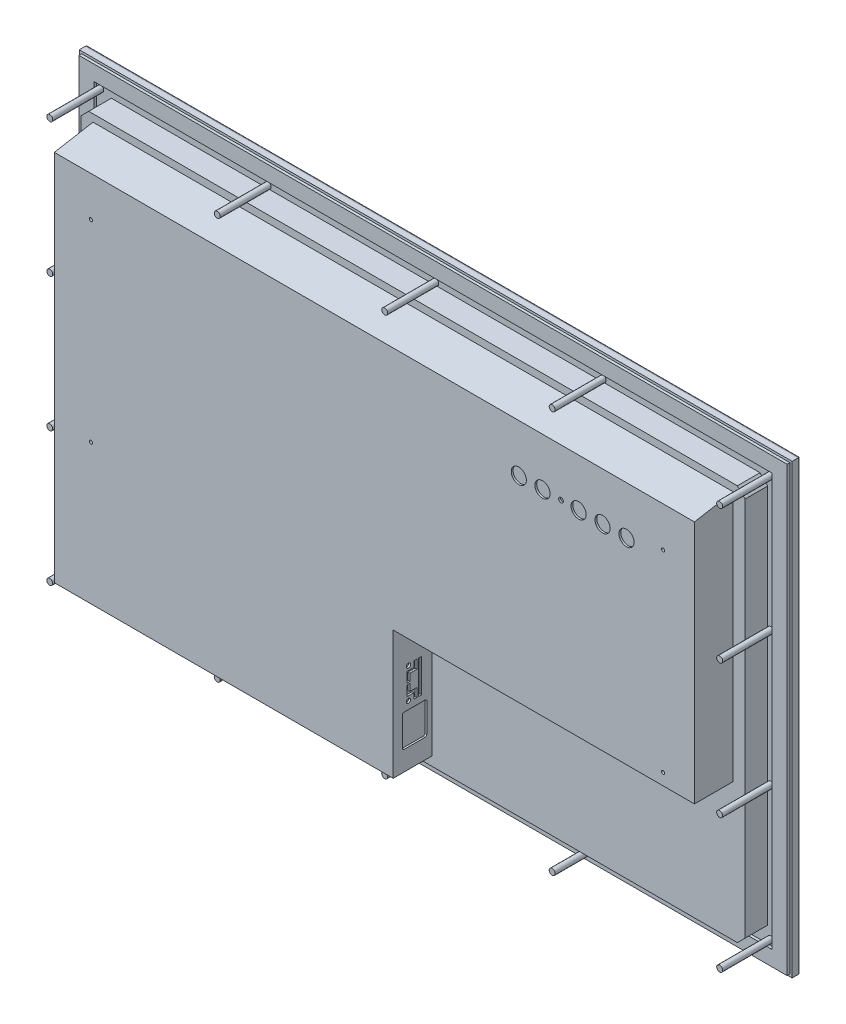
SolidWorks part; units mm, degrees
ref_plane "Front Plane" through (0, 0, 0) normal (0, 0, 1) x (1, 0, 0)
ref_plane "Top Plane" through (0, 0, 0) normal (0, 1, 0) x (1, 0, 0)
ref_plane "Right Plane" through (0, 0, 0) normal (1, 0, 0) x (0, 0, -1)
sketch "Sketch1" plane through (0, 0, 0) normal (0, 0, 1) x (1, 0, 0)
  line L0 (-298.45, 187.325) -> (298.45, 187.325)
  line L1 (298.45, 187.325) -> (298.45, -187.325)
  line L2 (298.45, -187.325) -> (-298.45, -187.325)
  line L3 (-298.45, -187.325) -> (-298.45, 187.325)
  point P2 (0, -187.325)
  point P3 (298.45, 0)
  dimension "D1" = 596.9
  dimension "D2" = 374.65
extrude "Bezel" add sketch "Sketch1" against normal blind 7.112
fillet "Bezel Radius" radius 2 4 edges at (0, -187.325, -7.112) (0, 187.325, -7.112) (-298.45, 0, -7.112) (298.45, 0, -7.112)
sketch "Sketch2" plane through (0, 0, -7.112) normal (0, 0, -1) x (-1, 0, 0)
  line L0 (-256.7686, 145.2626) -> (256.7686, 145.2626)
  line L1 (256.7686, 145.2626) -> (256.7686, -145.2626)
  line L2 (256.7686, -145.2626) -> (-256.7686, -145.2626)
  line L3 (-256.7686, -145.2626) -> (-256.7686, 145.2626)
  line L4 (296.45, 185.325) -> (-296.45, 185.325) construction
  line L5 (-296.45, 185.325) -> (-296.45, -185.325) construction
  point P0 (0, 145.2626)
  point P6 (0, 185.325)
  point P8 (-256.7686, 0)
  point P11 (-296.45, 0)
  dimension "D1" = 513.5372
  dimension "D2" = 290.5252
extrude "Window" cut sketch "Sketch2" against normal blind 2.35
sketch "Sketch3" plane through (0, 0, 0) normal (0, 0, 1) x (1, 0, 0)
  line L4 (-296.545, 185.42) -> (296.545, 185.42)
  line L5 (296.545, 185.42) -> (296.545, -185.42)
  line L6 (296.545, -185.42) -> (-296.545, -185.42)
  line L7 (-296.545, -185.42) -> (-296.545, 185.42)
  line L8 (298.45, 187.325) -> (-298.45, 187.325) construction
  line L9 (-298.45, 187.325) -> (-298.45, -187.325) construction
  line L10 (-298.45, -187.325) -> (298.45, -187.325) construction
  line L11 (298.45, -187.325) -> (298.45, 187.325) construction
  line L12 (-283.845, -172.72) -> (-283.845, 172.72)
  line L13 (-283.845, 172.72) -> (283.845, 172.72)
  line L14 (283.845, 172.72) -> (283.845, -172.72)
  line L15 (283.845, -172.72) -> (-283.845, -172.72)
  dimension "D1" = 1.905
  dimension "D2" = 1.905
  dimension "D3" = 1.905
  dimension "D4" = 1.905
  dimension "D5" = 12.7
extrude "Gasket" add sketch "Sketch3" along normal blind 2.3
sketch "Sketch5" plane through (0, 0, 0) normal (0, 0, 1) x (1, 0, 0)
  line L0 (-298.45, 187.325) -> (-298.45, -187.325) construction
  line L1 (298.45, 187.325) -> (-298.45, 187.325) construction
  circle A0 centre (-280.4668, 168.1226) radius 2.5
  circle A22 centre (-140.2334, 168.1226) radius 2.5
  circle A23 centre (-140.2334, -168.148) radius 2.5
  circle A24 centre (0, 168.1226) radius 2.5
  circle A25 centre (0, -168.148) radius 2.5
  circle A26 centre (140.2334, 168.1226) radius 2.5
  circle A27 centre (140.2334, -168.148) radius 2.5
  circle A28 centre (280.4668, 168.1226) radius 2.5
  circle A29 centre (280.4668, -168.148) radius 2.5
  circle A31 centre (-280.4668, -56.0578) radius 2.5
  circle A32 centre (-280.4668, -168.148) radius 2.5
  circle A33 centre (-280.4668, 56.0324) radius 2.5
  circle A34 centre (-280.4668, 56.0324) radius 2.5
  circle A35 centre (280.4668, 56.0324) radius 2.5
  circle A36 centre (-280.4668, -56.0578) radius 2.5
  circle A37 centre (280.4668, -56.0578) radius 2.5
  point P2 (0, 0)
  dimension "D1" = 5
  dimension "D2" = 17.9832
  dimension "D3" = 19.2024
  dimension "D4" = 3
  dimension "D5" = 140.2334
  dimension "D6" = 5
  dimension "D7" = 4
  dimension "D8" = 112.0902
extrude "Panel Frame Studs" add sketch "Sketch5" along normal blind 42.7
sketch "Sketch6" plane through (0, 0, 0) normal (0, 0, 1) x (1, 0, 0)
  line L0 (-277.9668, 159.2107) -> (-271.5549, 165.6226)
  line L1 (-271.5549, 165.6226) -> (271.5549, 165.6226)
  line L2 (271.5549, 165.6226) -> (277.9668, 159.2107)
  line L3 (277.9668, 159.2107) -> (277.9668, -159.2361)
  line L4 (277.9668, -159.2361) -> (271.5549, -165.648)
  line L5 (271.5549, -165.648) -> (-271.5549, -165.648)
  line L6 (-271.5549, -165.648) -> (-277.9668, -159.2361)
  line L7 (-277.9668, -159.2361) -> (-277.9668, 159.2107)
  circle A0 centre (-280.4668, 168.1226) radius 2.5 construction
  circle A6 centre (280.4668, 56.0324) radius 2.5 construction
  circle A7 centre (-140.2334, -168.148) radius 2.5 construction
  dimension "D1" = 9.0678
  dimension "D2" = 45
extrude "Body" add sketch "Sketch6" along normal blind 18.9738 separate body
sketch "Sketch7" plane through (0, 0, 18.9738) normal (0, 0, 1) x (1, 0, 0)
  line L0 (-267.97, 159.5374) -> (267.97, 159.5374)
  line L1 (267.97, 159.5374) -> (267.97, -50.673)
  line L2 (267.97, -50.673) -> (15.7226, -50.673)
  line L3 (15.7226, -50.673) -> (15.7226, -158.242)
  line L4 (15.7226, -158.242) -> (-267.97, -158.242)
  line L5 (-267.97, -158.242) -> (-267.97, 159.5374)
  line L6 (-271.5549, -165.648) -> (271.5549, -165.648) construction
  line L7 (-298.45, -187.325) -> (298.45, -187.325) construction
  line L9 (-277.9668, 159.2107) -> (-277.9668, -159.2361) construction
  point P3 (0, 159.5374)
  dimension "D1" = 535.94
  dimension "D2" = 210.2104
  dimension "D3" = 252.2474
  dimension "D4" = 107.569
  dimension "D5" = 29.083
extrude "Rear Cover" add sketch "Sketch7" along normal blind 32.3596
draft "Rear Cover Slope" type of draft neutral plane draft angle 10 faces to draft 1 parameters "D1"=10
sketch "Sketch10" plane through (0, -50.673, 0) normal (0, 1, 0) x (1, 0, 0)
  line L0 (267.97, -51.3334) -> (267.97, -18.9738) construction
  line L1 (15.7226, -51.3334) -> (267.97, -51.3334) construction
  line L2 (267.97, -51.3334) -> (-267.97, -51.3334) construction
  line L3 (267.97, -51.3334) -> (267.97, -18.9738) construction
  line L53 (123.8897, -41.2565) -> (123.8897, -36.1765)
  line L54 (99.6137, -44.429) -> (120.8417, -44.429)
  line L55 (99.6137, -33.0041) -> (120.8417, -33.0041)
  line L56 (96.5657, -36.1765) -> (96.5657, -41.2565)
  line L57 (160.3187, -37.6878) -> (160.3187, -42.7678)
  line L58 (143.0467, -45.9403) -> (157.2707, -45.9403)
  line L59 (139.9987, -37.6878) -> (139.9987, -42.7678)
  line L60 (143.0467, -34.5154) -> (157.1431, -34.5128)
  line L61 (198.4857, -27.9342) -> (198.4857, -33.0142)
  line L62 (215.7577, -24.7618) -> (201.5337, -24.7618)
  line L63 (218.8057, -33.0142) -> (218.8057, -27.9342)
  line L64 (201.5337, -36.1867) -> (215.6301, -36.1892)
  line L65 (252.2531, -24.3655) -> (236.2511, -24.3655)
  line L66 (252.2531, -32.049) -> (252.2531, -36.5575)
  line L67 (236.2511, -36.5575) -> (252.2531, -36.5575)
  line L68 (236.2511, -32.049) -> (236.2511, -36.5575)
  line L69 (231.8061, -32.049) -> (236.2511, -32.049)
  line L70 (231.8061, -28.874) -> (236.2511, -28.874)
  line L71 (236.2511, -24.3655) -> (236.2511, -28.874)
  line L72 (252.2531, -28.874) -> (252.2531, -24.3655)
  line L73 (252.2531, -32.049) -> (256.6981, -32.049)
  line L74 (252.2531, -28.874) -> (256.6981, -28.874)
  circle A42 centre (126.4837, -38.7165) radius 1.5875
  arc A43 (123.8897, -41.2565) -> (120.8417, -44.429) centre (120.7147, -41.2565) cw
  arc A44 (120.8417, -33.0041) -> (123.8897, -36.1765) centre (120.7147, -36.1765) cw
  arc A45 (96.5657, -36.1765) -> (99.6137, -33.0041) centre (99.7407, -36.1765) cw
  arc A46 (99.6137, -44.429) -> (96.5657, -41.2565) centre (99.7407, -41.2565) cw
  circle A47 centre (93.9717, -38.7165) radius 1.5875
  arc A48 (143.0467, -45.9403) -> (139.9987, -42.7678) centre (143.1737, -42.7678) cw
  circle A49 centre (162.6587, -40.2405) radius 1.5875
  arc A50 (160.3187, -42.7678) -> (157.2707, -45.9403) centre (157.1437, -42.7678) cw
  circle A51 centre (137.6587, -40.2405) radius 1.5875
  arc A52 (139.9987, -37.6878) -> (143.0467, -34.5154) centre (143.1737, -37.6878) cw
  arc A53 (157.1431, -34.5128) -> (160.3187, -37.6878) centre (157.1437, -37.6878) cw
  circle A54 centre (196.1457, -30.4615) radius 1.5875
  arc A55 (198.4857, -27.9342) -> (201.5337, -24.7618) centre (201.6607, -27.9342) cw
  arc A56 (215.7577, -24.7618) -> (218.8057, -27.9342) centre (215.6307, -27.9342) cw
  arc A57 (218.8057, -33.0142) -> (215.6301, -36.1892) centre (215.6307, -33.0142) cw
  arc A58 (201.5337, -36.1867) -> (198.4857, -33.0142) centre (201.6607, -33.0142) cw
  circle A59 centre (221.1457, -30.4615) radius 1.5875
  arc A60 (231.8061, -32.049) -> (231.8061, -28.874) centre (231.8061, -30.4615) cw
  arc A61 (256.6981, -28.874) -> (256.6981, -32.049) centre (256.6981, -30.4615) cw
  point P8 (0, 0)
  point P9 (0, 0)
  dimension "D1" = 11.2719
  dimension "D2" = 20.8719
  dimension "D3" = 11.0929
  dimension "D4" = 105.3113
extrude "Video / Touch Interface" cut sketch "Sketch10" along normal blind 1.524 from surface at 0
sketch "Sketch11" plane through (15.7226, 0, 0) normal (-1, 0, 0) x (0, 0, 1)
  line L0 (51.3334, -158.242) -> (18.9738, -158.242) construction
  line L1 (51.3334, -158.242) -> (51.3334, -50.673) construction
  line L2 (34.036, -109.6179) -> (34.036, -104.8046)
  line L3 (34.036, -109.6179) -> (31.496, -109.6179)
  line L8 (31.496, -109.6179) -> (31.496, -102.2646)
  line L9 (29.972, -81.6779) -> (29.972, -109.6179)
  line L10 (29.972, -109.6179) -> (27.432, -109.6179)
  line L11 (27.432, -109.6179) -> (27.432, -81.6779)
  line L12 (27.432, -81.6779) -> (29.972, -81.6779)
  line L13 (31.496, -81.6779) -> (34.036, -81.6779)
  line L14 (34.036, -81.6779) -> (34.036, -86.4912)
  line L15 (31.496, -81.6779) -> (31.496, -89.0312)
  line L16 (31.496, -89.0312) -> (37.3888, -89.0312)
  line L17 (34.036, -86.4912) -> (39.9288, -86.4912)
  line L18 (39.9288, -86.4912) -> (39.9288, -94.8859)
  line L19 (39.9288, -94.8859) -> (37.3888, -94.8859)
  line L20 (37.3888, -89.0312) -> (37.3888, -94.8859)
  line L21 (37.3888, -96.4099) -> (39.9288, -96.4099)
  line L22 (39.9288, -104.8046) -> (39.9288, -96.4099)
  line L23 (37.3888, -96.4099) -> (37.3888, -102.2646)
  line L24 (31.496, -102.2646) -> (37.3888, -102.2646)
  line L25 (34.036, -104.8046) -> (39.9288, -104.8046)
  line L69 (23.1777, -116.3501) -> (23.1777, -140.2896)
  line L70 (24.7017, -114.8261) -> (42.1531, -114.8261)
  line L71 (43.6756, -140.2896) -> (43.6756, -116.3501)
  line L72 (42.1516, -141.8136) -> (24.7002, -141.8136)
  circle A0 centre (38.5318, -108.4368) radius 1.7907
  circle A1 centre (38.5318, -82.859) radius 1.7907
  arc A14 (24.7002, -141.8136) -> (23.1777, -140.2896) centre (24.7017, -140.2896) cw
  arc A15 (23.1777, -116.3501) -> (24.7017, -114.8261) centre (24.7017, -116.3501) cw
  arc A16 (42.1531, -114.8261) -> (43.6756, -116.3501) centre (42.1516, -116.3501) cw
  arc A17 (43.6756, -140.2896) -> (42.1516, -141.8136) centre (42.1516, -140.2896) cw
  dimension "D1" = 16.4284
  dimension "D2" = 7.6578
extrude "Power AC and DC" cut sketch "Sketch11" along normal blind 1.524 from surface at 0
sketch "Sketch12" plane through (0, 0, 51.3334) normal (0, 0, 1) x (1, 0, 0)
  line L0 (-298.45, -187.325) -> (298.45, -187.325) construction
  line L1 (-298.45, 187.325) -> (-298.45, -187.325) construction
  circle A0 centre (120.9294, 113.7412) radius 6.35
  circle A1 centre (140.7414, 113.7412) radius 6.35
  circle A2 centre (170.9674, 113.7412) radius 6.35
  circle A3 centre (191.0334, 113.7412) radius 6.35
  circle A4 centre (156.2354, 113.7412) radius 1.9812
  circle A5 centre (211.0994, 113.7412) radius 6.35
  dimension "D8" = 301.0662
  dimension "D9" = 419.3794
  dimension "D4" = 20.066
  dimension "D6" = 12.7
  dimension "D7" = 3.9624
  dimension "D1" = 19.812
  dimension "D2" = 30.226
  dimension "D3" = 20.066
  dimension "D5" = 15.494
extrude "Controls Buttons" cut sketch "Sketch12" against normal blind 1.524 from surface at 0
hole_wizard "6-32 Accessory Bracket Holes" positions "Sketch13" profile "Sketch14" hole size "#6-32" standard "ANSI Inch"
sketch "Sketch13" plane through (0, 0, 51.3334) normal (0, 0, 1) x (1, 0, 0)
  line L0 (-298.45, 187.325) -> (-298.45, -187.325) construction
  line L1 (-298.45, -187.325) -> (298.45, -187.325) construction
  point P0 (-237.3122, -40.9956)
  point P2 (-237.3122, 120.3452)
  point P4 (241.7318, 120.3452)
  point P6 (241.7318, -40.9956)
  dimension "D1" = 161.3408
  dimension "D2" = 479.044
  dimension "D3" = 61.1378
  dimension "D4" = 146.3294
sketch "Sketch14" plane through (-237.3122, -40.9956, 51.3334) normal (1, 0, 0) x (0, -1, 0)
  line L0 (0, 0) -> (0, 16.8147)
  line L1 (0, 16.8147) -> (1.3525, 16.002)
  line L2 (1.3525, 16.002) -> (1.3525, 0)
  line L5 (1.3525, 0) -> (0, 0)
  line L10 (0, 16.8147) -> (-1.3526, 16.002) construction
  line L11 (0, -6.35) -> (0, 107.95) construction
  dimension "Hole Dia." = 2.7051
  dimension "Hole Depth" = 16.002
  dimension "Drill Angle" = 118
